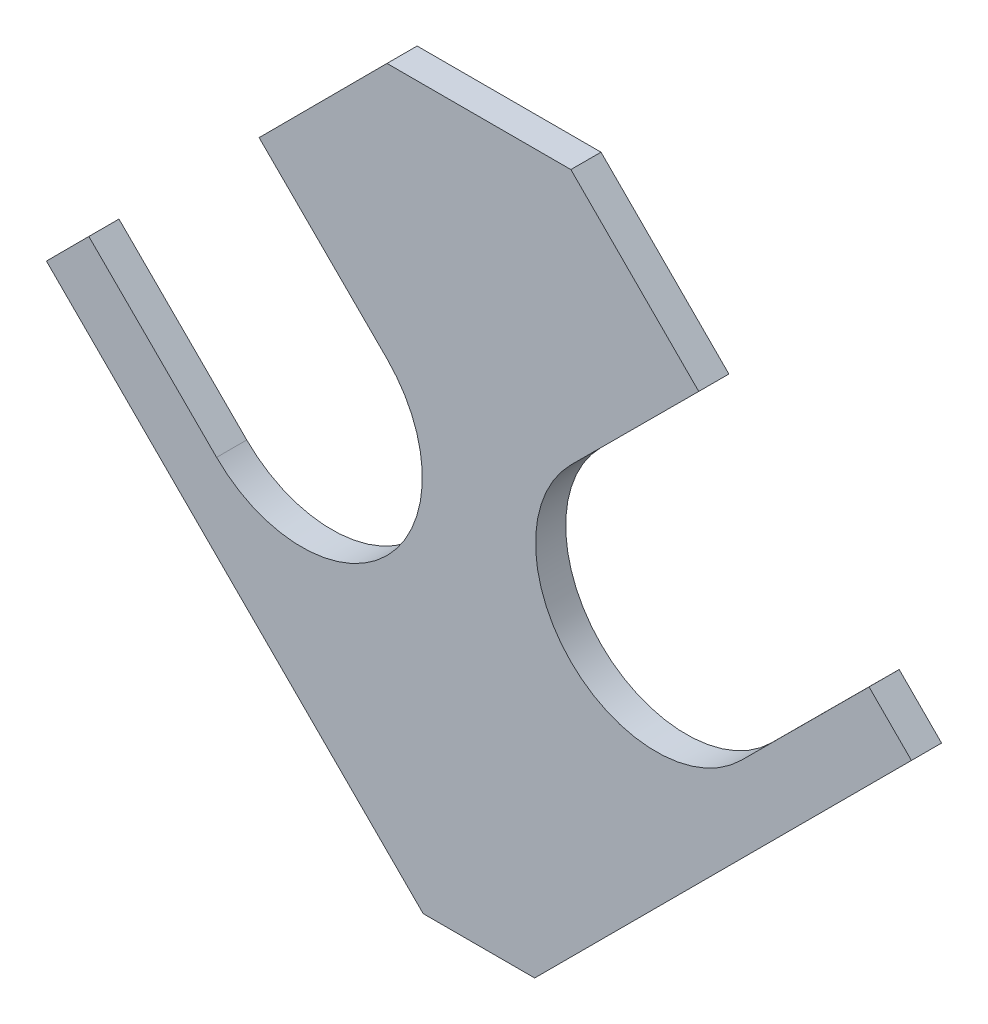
SolidWorks part; units mm, degrees
ref_plane "Front Plane" through (0, 0, 0) normal (0, 0, 1) x (1, 0, 0)
ref_plane "Top Plane" through (0, 0, 0) normal (0, 1, 0) x (1, 0, 0)
ref_plane "Right Plane" through (0, 0, 0) normal (1, 0, 0) x (0, 0, -1)
sketch "Sketch1" plane through (0, 0, 0) normal (0, 0, 1) x (1, 0, 0)
  line L0 (-23.4854, 23.4854) -> (23.4854, 23.4854)
  line L1 (23.4854, 23.4854) -> (182.2354, 182.2354) construction
  line L2 (23.4854, 23.4854) -> (182.2354, 182.2354)
  line L3 (-23.4854, 23.4854) -> (-182.2354, 182.2354) construction
  line L4 (-23.4854, 23.4854) -> (-182.2354, 182.2354)
  line L6 (-38.7382, 326.1064) -> (38.7382, 326.1064) construction
  line L7 (-38.7382, 326.1064) -> (38.7382, 326.1064)
  line L8 (-182.2354, 182.2354) -> (-38.7382, 326.1064)
  line L9 (182.2354, 182.2354) -> (38.7382, 326.1064)
  circle A0 centre (-74.6592, 182.4223) radius 50.8 construction
  circle A1 centre (74.6592, 182.4223) radius 50.8 construction
  circle A2 centre (-74.6592, 182.4223) radius 50.8
  circle A3 centre (74.6592, 182.4223) radius 50.8
extrude "Extrude1" add sketch "Sketch1" along normal blind 12.7
sketch "Sketch2" plane through (0, 0, 12.7) normal (0, 0, 1) x (1, 0, 0)
  line L0 (38.785, 218.39) -> (92.6195, 272.0847)
  line L1 (164.3681, 200.1493) -> (110.5335, 146.4546)
  line L2 (-110.5335, 146.4546) -> (-164.3681, 200.1493)
  line L3 (-38.785, 218.39) -> (-92.6195, 272.0847)
  line L4 (182.2354, 182.2354) -> (38.7382, 326.1064) construction
  line L5 (-38.7382, 326.1064) -> (-182.2354, 182.2354) construction
  line L6 (164.3681, 200.1493) -> (92.6195, 272.0847)
  line L7 (-92.6195, 272.0847) -> (-164.3681, 200.1493)
  circle A0 centre (74.6592, 182.4223) radius 50.8 construction
  circle A1 centre (-74.6592, 182.4223) radius 50.8 construction
  arc A2 (110.5335, 146.4546) -> (38.785, 218.39) centre (74.6592, 182.4223) ccw
  arc A3 (-38.785, 218.39) -> (-110.5335, 146.4546) centre (-74.6592, 182.4223) ccw
extrude "Cut-Extrude1" cut sketch "Sketch2" against normal up to next
